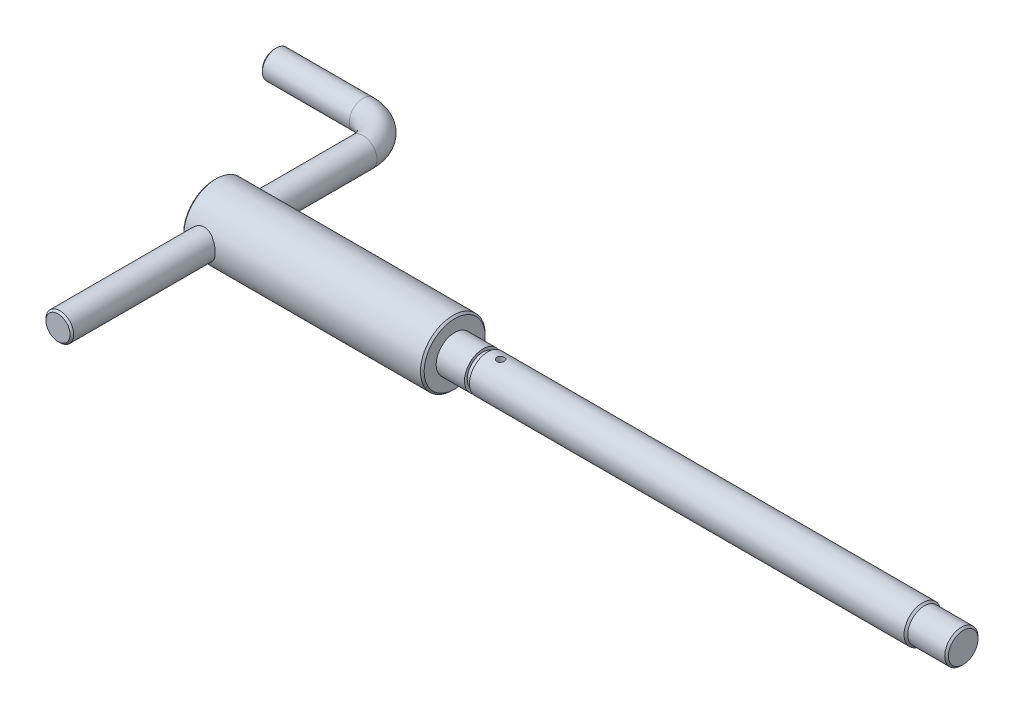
SolidWorks part; units mm, degrees
ref_plane "Plan1" through (0, 0, 0) normal (0, 0, 1) x (1, 0, 0)
ref_plane "Plan2" through (0, 0, 0) normal (0, 1, 0) x (1, 0, 0)
ref_plane "Plan3" through (0, 0, 0) normal (1, 0, 0) x (0, 0, -1)
ref_plane "Plan4" through (-63, 0, 0) normal (1, 0, 0) x (0, 0, -1)
sketch "Esquisse3" plane through (0, 0, 0) normal (0, 0, 1) x (1, 0, 0)
  line L0 (0, 0) -> (370.4885, 0) construction
  line L2 (0, 0) -> (0, 17.5)
  line L3 (0, 17.5) -> (130, 17.5)
  line L4 (130, 17.5) -> (130, 10)
  line L5 (130, 10) -> (145.3, 10)
  line L6 (145.3, 10) -> (145.3, 8.5)
  line L7 (145.3, 8.5) -> (148, 8.5)
  line L8 (148, 8.5) -> (148, 10)
  line L9 (148, 10) -> (405, 10)
  line L13 (0, 0) -> (405, 0)
  line L14 (405, 10) -> (405, 0)
  dimension "D1" = 275
  dimension "D2" = 18
  dimension "D4" = 20
  dimension "D5" = 20
  dimension "D6" = 17
  dimension "D7" = 35
  dimension "D8" = 130
  dimension "D9" = 2.7
ref_plane "Plan5" through (0, 0, 10) normal (0, 0, 1) x (1, 0, 0)
revolve "Révolution1" add sketch "Esquisse3" angle 360 about L0
sketch "Esquisse4" plane through (0, 0, 10) normal (0, -1, 0) x (1, 0, 0)
  line L1 (0, 7.5) -> (0, -27.5) construction
  line L2 (0, -10) -> (233.6879, -10) construction
  circle A0 centre (154.91, -10) radius 2
  dimension "D1" = 154.91
  dimension "D2" = 4
extrude "Enlèv. mat.-Extru.1" cut sketch "Esquisse4" against normal through all and the other way through all
sketch "Esquisse5" plane through (0, 0, 0) normal (0, 1, 0) x (1, 0, 0)
  line L0 (10.5, -95) -> (10.5, 70)
  line L1 (-7, 87.5) -> (-55, 87.5)
  line L2 (0, 17.5) -> (0, -17.5) construction
  arc A0 (10.5, 70) -> (-7, 87.5) centre (-7, 70) ccw
  point P8 (10.5, 87.5)
  dimension "D5" = 17.5
  dimension "D1" = 10.5
  dimension "D2" = 95
  dimension "D3" = 87.5
  dimension "D4" = 65.5
ref_plane "Plan6" through (0, 0, 95) normal (0, 0, 1) x (1, 0, 0)
sketch "Esquisse6" plane through (0, 0, 95) normal (0, 0, 1) x (1, 0, 0)
  circle A0 centre (10.5, 0) radius 7.5
  dimension "D1" = 15
sweep "Balayage1" add profiles "Esquisse6" path "Esquisse5"
chamfer "Chanfrein1" distance 1 angle 45 2 edges at (18, 0, 95) (-55, 0, -95)
chamfer "Chanfrein2" distance 1 angle 45 1 edges at (405, 0, 10)
sketch "Esquisse7" plane through (405, 0, 0) normal (1, 0, 0) x (0, 0, -1)
  circle A0 centre (0, 0) radius 11
  circle A1 centre (0, 0) radius 9
  dimension "D1" = 22
  dimension "D2" = 18
extrude "Extrusion1" cut sketch "Esquisse7" against normal blind 21
chamfer "Chanfrein3" distance 1 angle 45 2 edges at (384, 0, -10) (405, 0, -9)
chamfer "Chanfrein4" distance 1 angle 45 2 edges at (0, 0, 17.5) (130, 0, 17.5)
thread "Filetage1" pitch 1.5 start angle 0, offset 3, length 0, pitch 1.5, diameter 20
ref_plane "Plan7" through (386, 0, 10) normal (0, -1, 0) x (0, 0, 1)
sketch "Profil de filetage1" plane through (386, 0, 10) normal (0, -1, 0) x (0, 0, 1)
  line L0 (0, 0) -> (0, 1.5) construction
  line L11 (0, 0) -> (0, 1.3125)
  line L12 (0, 1.3125) -> (-0.8119, 0.8437)
  line L13 (-0.8119, 0.8437) -> (-0.8119, 0.4687)
  line L15 (-0.8119, 0.4687) -> (0, 0)
  line L17 (-0.8119, 0.6562) -> (0, 0.6562) construction
  point P2 (0, 0)
  dimension "Pitch" = 1.5
  dimension "Profile_Angle" = 60
  dimension "Profile_Land" = 0.375
  dimension "Profile_Height" = 0.8119
